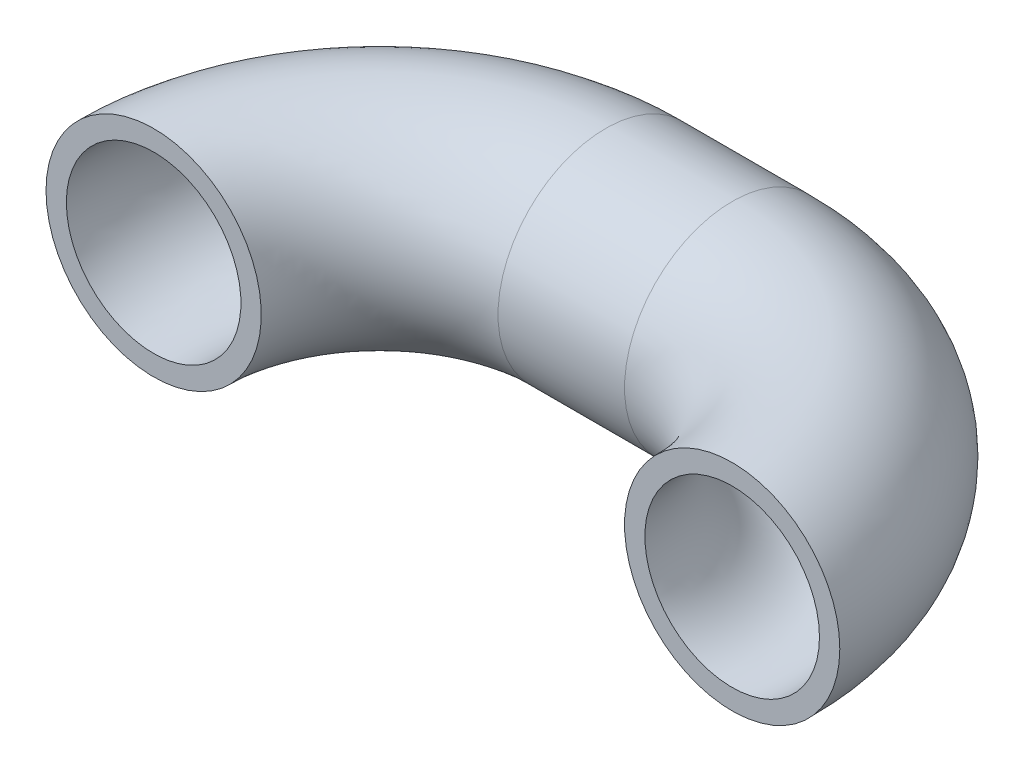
SolidWorks part; units mm, degrees
ref_plane "Alzado" through (0, 0, 0) normal (0, 0, 1) x (1, 0, 0)
ref_plane "Planta" through (0, 0, 0) normal (0, 1, 0) x (1, 0, 0)
ref_plane "Vista lateral" through (0, 0, 0) normal (1, 0, 0) x (0, 0, -1)
sketch "Croquis1" plane through (0, 0, 0) normal (0, 0, 1) x (1, 0, 0)
  line L1 (-10, 0) -> (-10, 10.2539) construction
  circle A0 centre (0, 0) radius 4.7625
  circle A1 centre (0, 0) radius 3.8625
  dimension "D1" = 9.525
  dimension "D2" = 7.725
revolve "Revolución1" add sketch "Croquis1" angle 90 about L1
sketch "Croquis2" plane through (-10, 0, 0) normal (-1, 0, 0) x (0, 0, 1)
  circle A0 centre (-10, 0) radius 3.8625 construction
  circle A1 centre (-10, 0) radius 4.7625 construction
  circle A2 centre (-10, 0) radius 3.8625
  circle A3 centre (-10, 0) radius 4.7625
extrude "Saliente-Extruir1" add sketch "Croquis2" along normal blind 5.5976
sketch "Croquis3" plane through (0, 0, 0) normal (0, 0, 1) x (1, 0, 0)
  line L1 (-15.5976, 0) -> (-15.5976, 8.5493) construction
  circle A0 centre (-25.5976, 0) radius 4.7625
  circle A1 centre (-25.5976, 0) radius 3.8625
  dimension "D1" = 9.525
  dimension "D2" = 7.725
revolve "Revolución2" add sketch "Croquis3" angle 90 about L1
